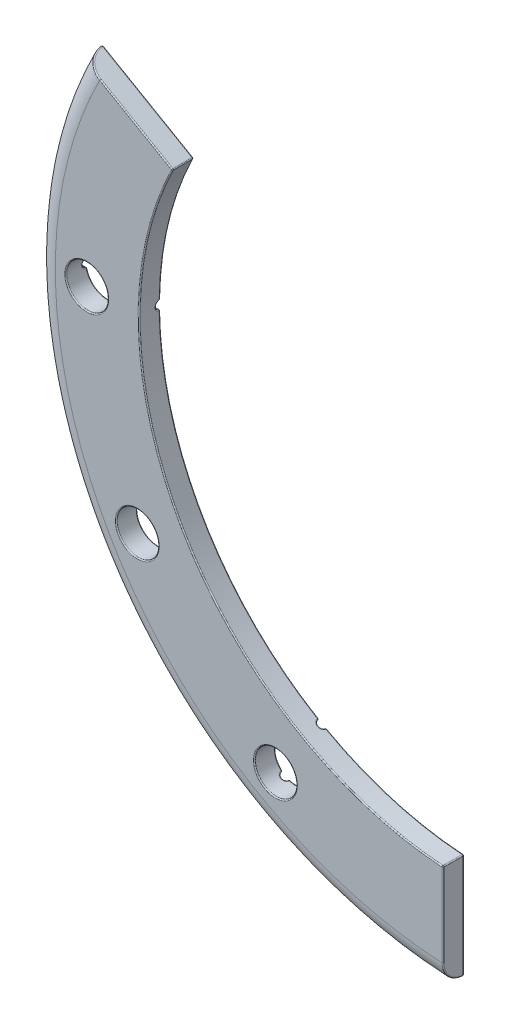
SolidWorks part; units mm, degrees
ref_plane "Спереди" through (0, 0, 0) normal (0, 0, 1) x (1, 0, 0)
ref_plane "Сверху" through (0, 0, 0) normal (0, 1, 0) x (1, 0, 0)
ref_plane "Справа" through (0, 0, 0) normal (1, 0, 0) x (0, 0, -1)
sketch "Эскиз1" plane through (0, 0, 0) normal (0, 0, 1) x (1, 0, 0)
  line L0 (0, 0) -> (-177.5352, 102.5) construction
  line L1 (0, 0) -> (0, -205) construction
  line L2 (-182.3239, 93.7177) -> (-138.9543, 68.6783)
  line L3 (-10, -204.756) -> (-10, -154.6771)
  line L4 (-205, 0) -> (0, 0) construction
  line L5 (0, 0) -> (-177.5352, -102.5) construction
  line L6 (0, 0) -> (-102.5, -177.5352) construction
  arc A0 (-182.3239, 93.7177) -> (-10, -204.756) centre (0, 0) ccw
  arc A1 (-138.9543, 68.6783) -> (-10, -154.6771) centre (0, 0) ccw
  arc A2 (-160.6438, 81.2007) -> (-10, -179.722) centre (0, 0) ccw construction
  circle A3 centre (0, 0) radius 155 construction
  circle A4 centre (0, 0) radius 180 construction
  circle A5 centre (0, 0) radius 205 construction
  circle A6 centre (-180, 0) radius 10
  circle A7 centre (-155.8846, -90) radius 10
  circle A8 centre (-90, -155.8846) radius 10
  dimension "D1" = 410
  dimension "D9" = 20
  dimension "D4" = 120
  dimension "D5" = 20
  dimension "D6" = 10
  dimension "D7" = 30
  dimension "D8" = 30
  dimension "D2" = 50
  dimension "D3" = 25
extrude "Бобышка-Вытянуть1" add sketch "Эскиз1" along normal blind 10
fillet "Скругление1" radius 10 1 edges at (-177.5352, -102.5, 10)
fillet "Скругление2" radius 0.5 17 edges at (-10, -179.7165, 0) (-10, -201.0043, 7.8039) (-10, -174.7103, 10) (-10, -154.6771, 5) (-134.2339, -77.5, 10) (-134.2339, -77.5, 0) (-80, -155.8846, 0) (-80, -155.8846, 10) (-145.8846, -90, 0) (-145.8846, -90, 10) (-170, 0, 0) (-170, 0, 10) (-138.9543, 68.6783, 5) (-156.3035, 78.6949, 10) (-180.4278, 92.623, 6.2413) (-160.6391, 81.198, 0) (-177.5352, -102.5, 0)
sketch "Эскиз2" plane through (0, 0, 0) normal (1, 0, 0) x (0, 0, -1)
  circle A0 centre (0, 0) radius 2
  dimension "D1" = 4
extrude "Вырез-Вытянуть1" cut sketch "Эскиз2" against normal through all
ref_plane "Плоскость1" through (0, 0, 0) normal (-0.866, -0.5, 0) x (0, 0, 1)
ref_plane "Плоскость2" through (0, 0, 0) normal (-0.5, -0.866, 0) x (0.866, -0.5, 0)
sketch "Эскиз4" plane through (0, 0, 0) normal (-0.5, -0.866, 0) x (0.866, -0.5, 0)
  circle A0 centre (0, 0) radius 2
  dimension "D1" = 4
extrude "Вырез-Вытянуть3" cut sketch "Эскиз4" along normal through all
fillet "Скругление4" radius 0.5 32 edges at (-96.6698, -163.4591, 0.2102) (-93.2395, -165.4819, 0.1644) (-86.7605, -146.2872, 0.1644) (-83.3302, -148.31, 0.2102) (-100.4283, -169.9468, 0) (-96.9642, -171.9468, 0) (-79.5628, -141.8068, 0) (-83.0269, -139.8068, 0) (-77.4457, -134.2653, 1.999) (-75.8413, -135.351, 0.1421) (-79.2702, -133.3187, 0.1931) (-84.9454, -147.2561, 1.999) (-102.2487, -177.4487, 1.9924) (-100.7205, -178.4306, 0.2117) (-95.0546, -164.5131, 1.999) (-104.131, -176.3677, 0.122) (-190.0021, 1.9975, 0.1003) (-169.9979, -1.9975, 0.1003) (-189.8947, -1.9889, 0.2102) (-170.1053, 1.9889, 0.2102) (-204.8044, -1.9963, 0.122) (-204.7992, -0.1597, 1.9936) (-204.8857, 1.9888, 0.2117) (-189.9998, -0.0631, 1.999) (-155.1852, 1.9974, 0.1014) (-155.0925, -1.9907, 0.1931) (-170.0002, 0.0631, 1.999) (-162.5897, 2, 0) (-162.5897, -2, 0) (-155, 0.0627, 1.999) (-197.3924, -2, 0) (-197.3924, 2, 0)
